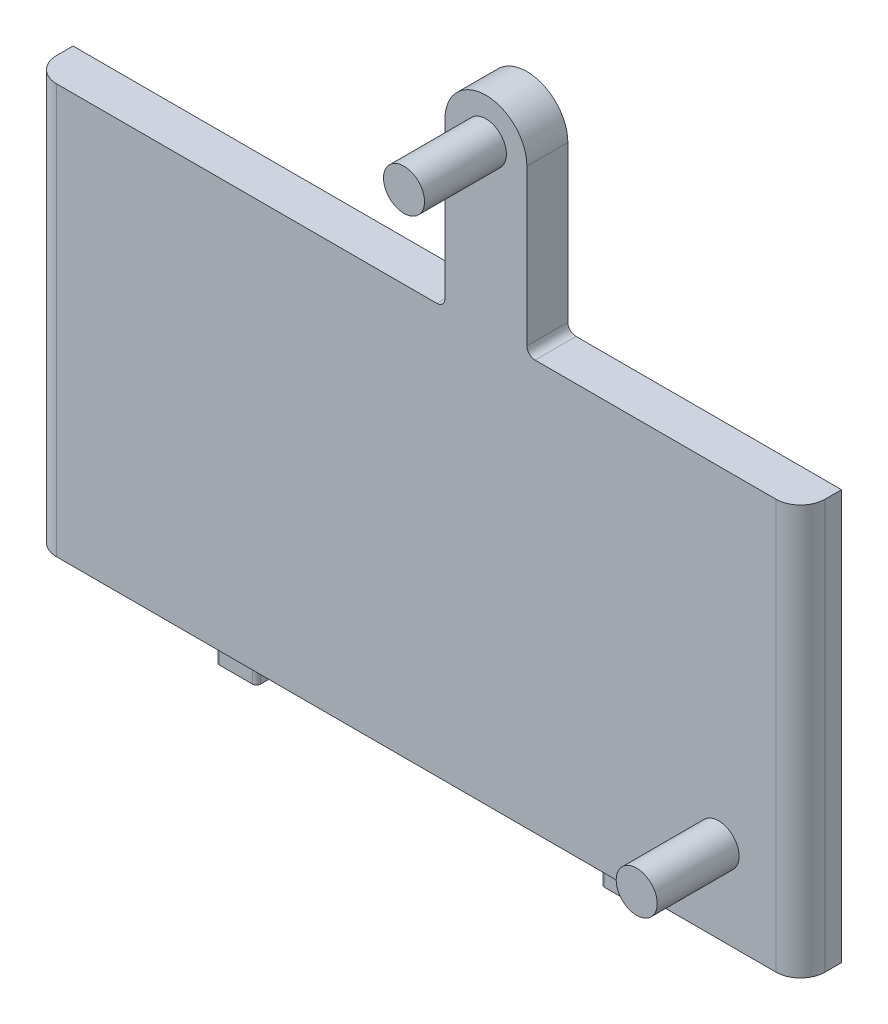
SolidWorks part; units mm, degrees
ref_plane "前视基准面" through (0, 0, 0) normal (0, 0, 1) x (1, 0, 0)
ref_plane "上视基准面" through (0, 0, 0) normal (0, 1, 0) x (1, 0, 0)
ref_plane "右视基准面" through (0, 0, 0) normal (1, 0, 0) x (0, 0, -1)
sketch "草图1" plane through (0, 0, 0) normal (0, 0, 1) x (1, 0, 0)
  line L1 (-46.9, -25) -> (46.9, -25)
  line L2 (-46.9, -25) -> (-46.9, 25)
  line L3 (-46.9, 25) -> (46.9, 25)
  line L4 (46.9, -25) -> (46.9, 25)
  line L5 (-46.9, -25) -> (46.9, 25) construction
  line L6 (-46.9, 25) -> (46.9, -25) construction
  point P0 (0, 0)
  dimension "D1" = 50
  dimension "D2" = 93.8
extrude "凸台-拉伸1" add sketch "草图1" along normal blind 5
fillet "圆角1" radius 3 2 edges at (-46.9, 0, 5) (46.9, 0, 5)
sketch "草图4" plane through (0, -25, 0) normal (0, -1, 0) x (1, 0, 0)
  line L0 (0, 22.807) -> (0, -21.4107) construction
  line L1 (-18, 28.4398) -> (-18, -21.4107) construction
  line L2 (-46.9, 0) -> (46.9, 0) construction
  line L3 (-25.5, 3.5) -> (-21.5, 3.5)
  line L4 (-26, 3) -> (-26, 2)
  line L5 (-25.5, 1.5) -> (-21.5, 1.5)
  line L6 (-21, 3) -> (-21, 2)
  line L7 (21, 3) -> (21, 2)
  line L8 (25.5, 1.5) -> (21.5, 1.5)
  line L9 (26, 3) -> (26, 2)
  line L10 (25.5, 3.5) -> (21.5, 3.5)
  arc A0 (-21.5, 3.5) -> (-21, 3) centre (-21.5, 3) cw
  arc A1 (-21.5, 1.5) -> (-21, 2) centre (-21.5, 2) ccw
  arc A2 (-26, 2) -> (-25.5, 1.5) centre (-25.5, 2) ccw
  arc A3 (-25.5, 3.5) -> (-26, 3) centre (-25.5, 3) ccw
  arc A4 (25.5, 3.5) -> (26, 3) centre (25.5, 3) cw
  arc A5 (26, 2) -> (25.5, 1.5) centre (25.5, 2) cw
  arc A6 (21.5, 1.5) -> (21, 2) centre (21.5, 2) cw
  arc A7 (21.5, 3.5) -> (21, 3) centre (21.5, 3) ccw
  point P13 (-21, 3.5)
  point P16 (-21, 1.5)
  point P21 (-26, 3.5)
  dimension "D6" = 0.5
  dimension "D1" = 18
  dimension "D2" = 3
  dimension "D3" = 2
  dimension "D4" = 5
  dimension "D5" = 1.5
extrude "凸台-拉伸3" add sketch "草图4" along normal blind 3
sketch "草图5" plane through (0, 0, 0) normal (0, 0, 1) x (1, 0, 0)
  line L0 (0, 52.4467) -> (0, -29.4055) construction
  line L1 (3.5, 25) -> (3.5, 45)
  line L2 (43.9, 25) -> (-43.9, 25) construction
  line L3 (13.5, 45) -> (13.5, 25)
  line L4 (3.5, 25) -> (13.5, 25)
  arc A0 (3.5, 45) -> (13.5, 45) centre (8.5, 45) cw
  dimension "D1" = 20
  dimension "D2" = 10
  dimension "D3" = 8.5
extrude "凸台-拉伸4" add sketch "草图5" along normal blind 5
sketch "草图6" plane through (0, 0, 5) normal (0, 0, 1) x (1, 0, 0)
  circle A0 centre (8.5, 45) radius 2.5
  dimension "D1" = 5
extrude "凸台-拉伸5" add sketch "草图6" along normal blind 10
fillet "圆角2" radius 1 2 edges
sketch "草图7" plane through (0, 0, 5) normal (0, 0, 1) x (1, 0, 0)
  line L0 (-43.9, -25) -> (43.9, -25) construction
  line L1 (43.9, -25) -> (43.9, 25) construction
  circle A0 centre (36.9, -15) radius 2.5
  dimension "D1" = 5
  dimension "D2" = 10
  dimension "D3" = 7
extrude "凸台-拉伸6" add sketch "草图7" along normal blind 10
sketch "草图3" plane through (0, 25, 0) normal (0, 1, 0) x (1, 0, 0)
  line L0 (0, 17.0795) -> (0, -18.0628) construction
  line L1 (46.9, 0) -> (14.5, 0) construction
  line L2 (46.9, -2) -> (46.9, 0) construction
  circle A0 centre (44.4, 0) radius 0.975
  circle A1 centre (-44.4, 0) radius 0.975
  dimension "D2" = 1.95
  dimension "D1" = 2.5
extrude "凸台-拉伸2" add sketch "草图3" against normal up to surface (50 mm away)
